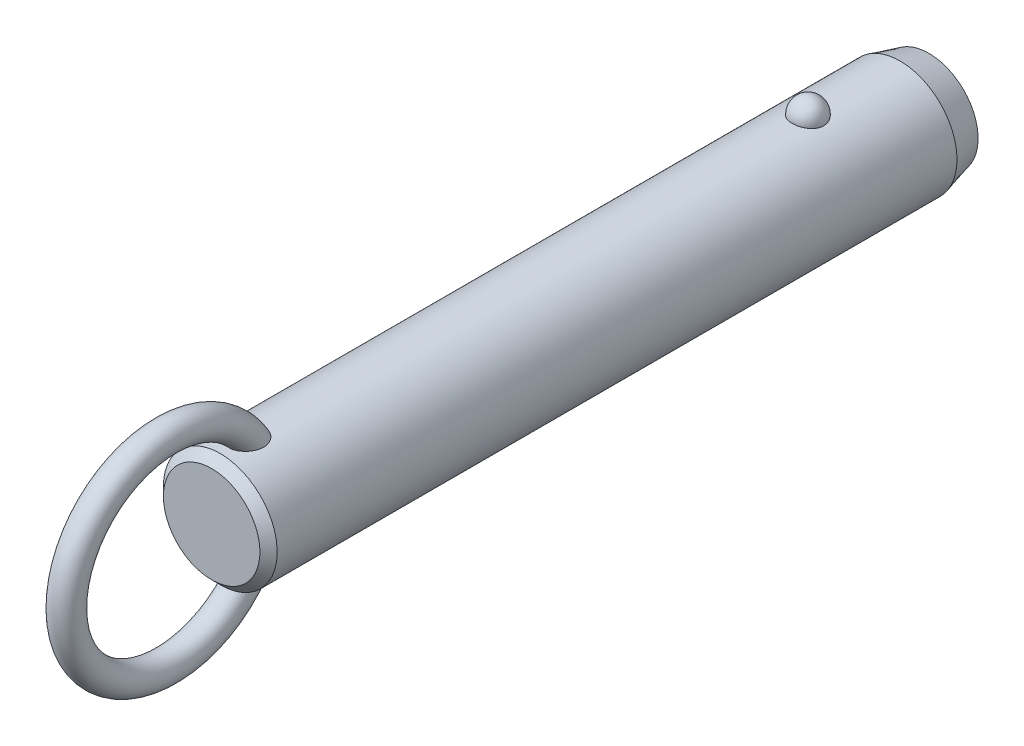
SolidWorks part; units mm, degrees
ref_plane "Front Plane" through (0, 0, 0) normal (0, 0, 1) x (1, 0, 0)
ref_plane "Top Plane" through (0, 0, 0) normal (0, 1, 0) x (1, 0, 0)
ref_plane "Right Plane" through (0, 0, 0) normal (1, 0, 0) x (0, 0, -1)
sketch "Sketch2" plane through (0, 0, 0) normal (0, 0, 1) x (1, 0, 0)
  circle A0 centre (0, 0) radius 7.9
  point P3 (0, 7.9)
  dimension "D1" = 15.8
extrude "Boss-Extrude1" add sketch "Sketch2" along normal blind 71.1
sketch "Sketch3" plane through (0, 0, 0) normal (0, 0, -1) x (-1, 0, 0)
  circle A0 centre (0, 0) radius 7.9
  dimension "D1" = 15.8
extrude "Boss-Extrude2" add sketch "Sketch3" along normal blind 19
chamfer "Chamfer1" distance 4 angle 15 1 edges at (-7.9, 0, -19)
sketch "Sketch12" plane through (0, 0, 0) normal (1, 0, 0) x (0, 0, -1)
  line L0 (-71.1, 7.9) -> (-71.1, -7.9) construction
  point P0 (-71.1, 0)
sketch "Sketch13" plane through (0, 0, 0) normal (1, 0, 0) x (0, 0, -1)
  circle A0 centre (-86.95, 0) radius 15.85
  point P2 (-71.1, 0)
  dimension "D1" = 31.7
sketch "Sketch14" plane through (0, 0, 0) normal (0, 1, 0) x (1, 0, 0)
  circle A0 centre (0, -73.1) radius 2
  point P2 (0, -71.1)
  dimension "D1" = 4
sweep "Sweep1" add profiles "Sketch14" path "Sketch13"
sketch "Sketch15" plane through (0, 0, 71.1) normal (0, 0, 1) x (1, 0, 0)
  circle A0 centre (0, 0) radius 7.9
  dimension "D1" = 15.8
extrude "Boss-Extrude3" add sketch "Sketch15" along normal blind 9.52
chamfer "Chamfer2" distance 1.2 angle 45 1 edges at (7.9, 0, 80.62)
sketch "Sketch18" plane through (0, 0, 0) normal (1, 0, 0) x (0, 0, -1)
  line L0 (15, 7.9) -> (-73.2091, 7.9) construction
  line L1 (2.2, 10.1) -> (2.2, 5.7)
  line L2 (-73.2091, -7.9) -> (15, -7.9) construction
  arc A0 (2.2, 10.1) -> (2.2, 5.7) centre (2.2, 7.9) ccw
  point P4 (0, 7.9)
  dimension "D1" = 18
revolve "Revolve1" add sketch "Sketch18" angle 360 about L1
